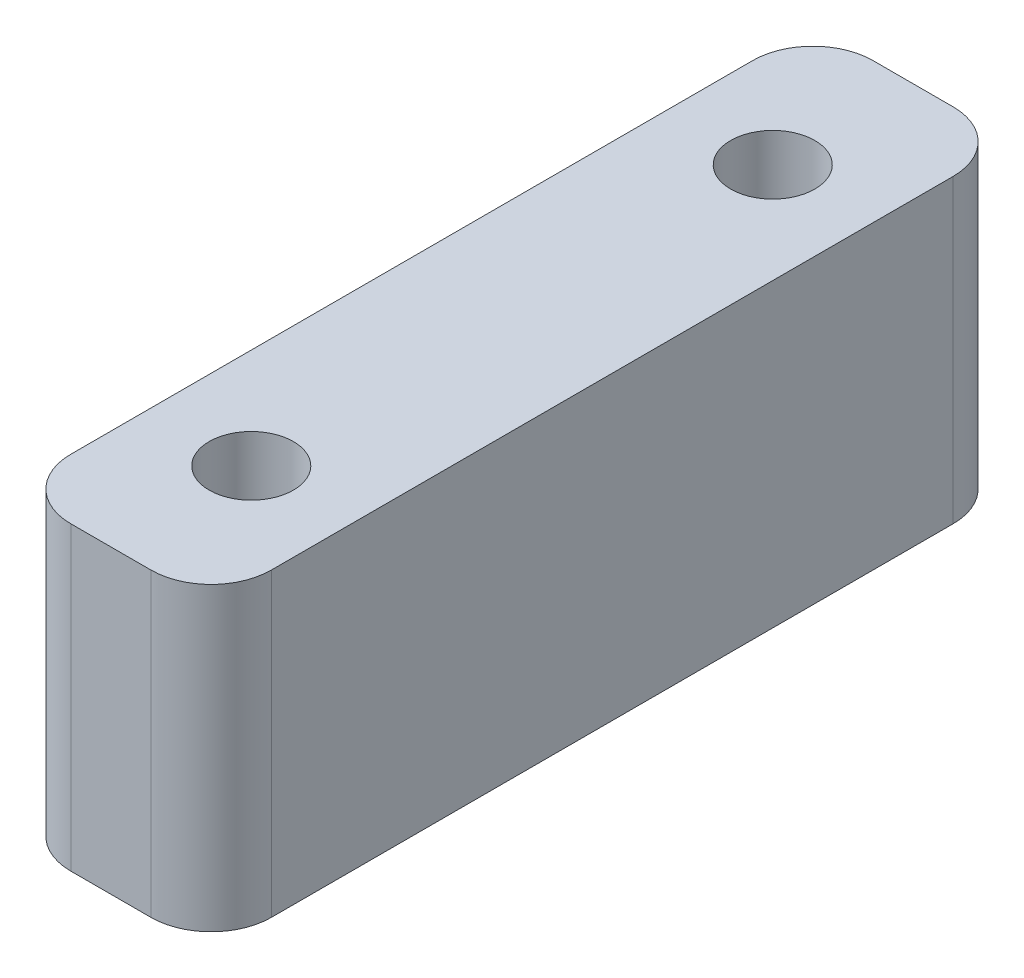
SolidWorks part; units mm, degrees
ref_plane "前视基准面" through (0, 0, 0) normal (0, 0, 1) x (1, 0, 0)
ref_plane "上视基准面" through (0, 0, 0) normal (0, 1, 0) x (1, 0, 0)
ref_plane "右视基准面" through (0, 0, 0) normal (1, 0, 0) x (0, 0, -1)
sketch "草图1" plane through (0, 0, 0) normal (0, 1, 0) x (1, 0, 0)
  line L5 (-10, 0) -> (0, 0)
  line L6 (-10, 0) -> (-10, -40)
  line L7 (-10, -40) -> (0, -40)
  line L8 (0, 0) -> (0, -40)
  circle A2 centre (-5, -7) radius 2.1
  circle A3 centre (-5, -33) radius 2.1
  point P18 (-10, -20)
  dimension "D5" = 0
  dimension "D8" = 26
  dimension "D9" = 13
  dimension "D10" = 4.2
  dimension "D11" = 4.2
  dimension "D16" = 5
  dimension "D17" = 5
  dimension "D2" = 0
  dimension "D3" = 10
  dimension "D4" = 40
extrude "凸台-拉伸1" add sketch "草图1" along normal blind 15
fillet "圆角1" radius 3 4 edges at (-10, 7.5, 40) (0, 7.5, 40) (0, 7.5, 0) (-10, 7.5, 0)
